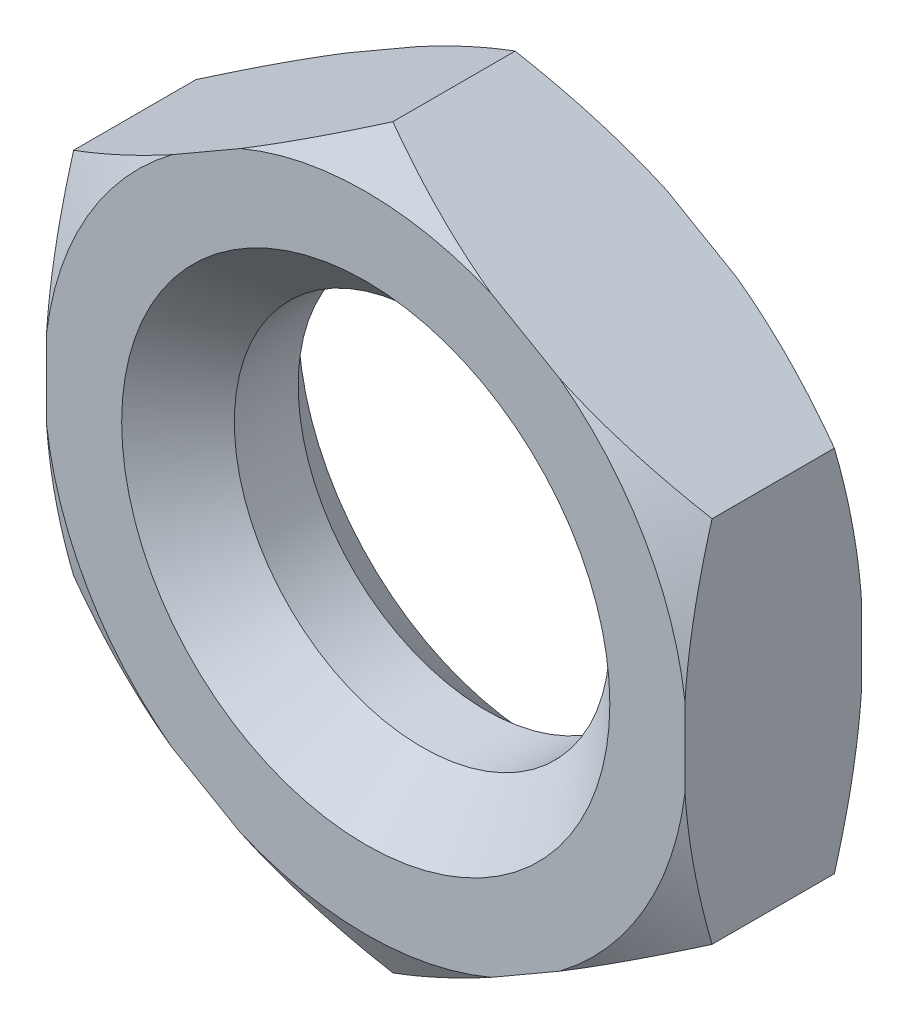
SolidWorks part; units mm, degrees
ref_plane "Front Plane" through (0, 0, 0) normal (0, 0, 1) x (1, 0, 0)
ref_plane "Top Plane" through (0, 0, 0) normal (0, 1, 0) x (1, 0, 0)
ref_plane "Right Plane" through (0, 0, 0) normal (1, 0, 0) x (0, 0, -1)
sketch "Sketch3" plane through (0, 0, 0) normal (0, 0, 1) x (1, 0, 0)
  line L1 (0, 9.815) -> (-8.5, 4.9075)
  line L2 (-8.5, 4.9075) -> (-8.5, -4.9075)
  line L3 (-8.5, -4.9075) -> (0, -9.815)
  line L4 (0, -9.815) -> (8.5, -4.9075)
  line L5 (8.5, -4.9075) -> (8.5, 4.9075)
  line L6 (8.5, 4.9075) -> (0, 9.815)
  circle A0 centre (0, 0) radius 8.5 construction
  dimension "D1" = 17
extrude "Boss-Extrude1" add sketch "Sketch3" along normal mid plane 4.7
sketch "Sketch4" plane through (0, 0, 0) normal (1, 0, 0) x (0, 0, -1)
  line L0 (-5.4578, 0) -> (6.1545, 0) construction
sketch "Sketch5" plane through (0, 0, 0) normal (1, 0, 0) x (0, 0, -1)
  line L0 (-2.35, 9.815) -> (-2.35, 8.565)
  line L1 (-2.35, 4.9075) -> (-2.35, 9.815) construction
  line L2 (-2.35, 8.565) -> (-1.6283, 9.815)
  line L3 (-2.35, 9.815) -> (2.35, 9.815) construction
  line L4 (-1.6283, 9.815) -> (-2.35, 9.815)
  dimension "D1" = 1.25
  dimension "D2" = 30
revolve "Cut-Revolve1" cut sketch "Sketch5" angle 360 about L0
mirror "Mirror1" about plane through (0, 0, 0) normal (0, 0, 1) of "Cut-Revolve1"
sketch "Sketch6" plane through (0, 0, 2.35) normal (0, 0, 1) x (1, 0, 0)
  circle A0 centre (0, 0) radius 5
  dimension "D1" = 10
extrude "Cut-Extrude1" cut sketch "Sketch6" against normal blind 4.7
chamfer "Chamfer1" distance 1.5 angle 45 2 edges at (5, 0, -2.35) (5, 0, 2.35)
